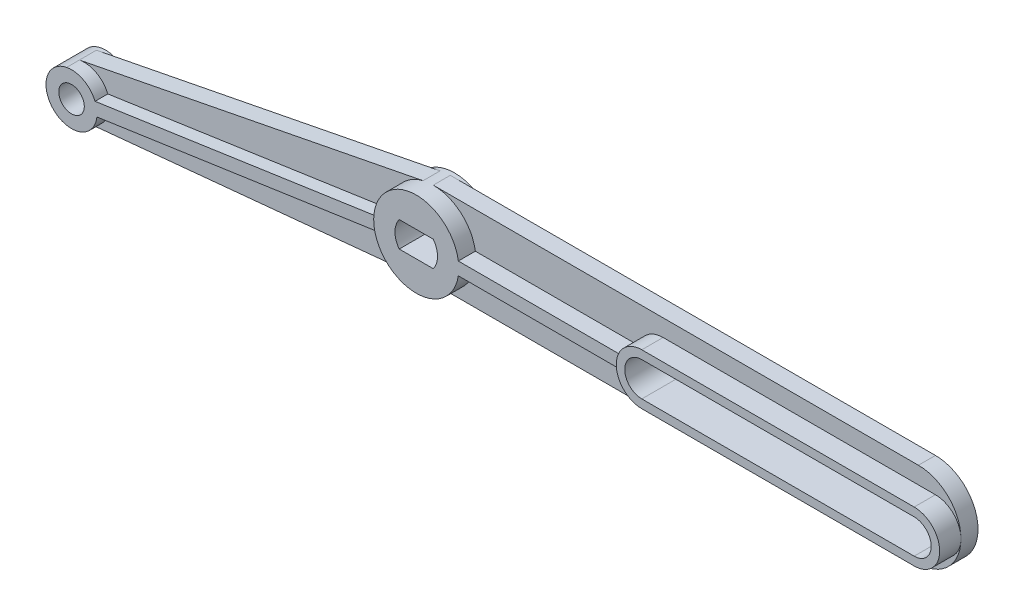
SolidWorks part; units mm, degrees
ref_plane "Face" through (0, 0, 0) normal (0, 0, 1) x (1, 0, 0)
ref_plane "Dessus" through (0, 0, 0) normal (0, 1, 0) x (1, 0, 0)
ref_plane "Droite" through (0, 0, 0) normal (1, 0, 0) x (0, 0, -1)
sketch "Esquisse2" plane through (0, 0, 0) normal (0, 0, 1) x (1, 0, 0)
  line L0 (0, 0) -> (120.7387, 0) construction
  line L1 (0, -5) -> (57, -5)
  line L2 (0, -5) -> (0, 5)
  line L3 (0, 5) -> (57, 5)
  arc A0 (57, -5) -> (57, 5) centre (57, 0) ccw
  dimension "D3" = 10
  dimension "D1" = 10
  dimension "D2" = 5
  dimension "D4" = 57
extrude "Extrusion1" add sketch "Esquisse2" along normal blind 2
sketch "Esquisse3" plane through (0, 0, 2) normal (0, 0, 1) x (1, 0, 0)
  circle A0 centre (0, 0) radius 5
  dimension "D1" = 10
extrude "Extrusion2" add sketch "Esquisse3" along normal blind 2 and the other way blind 2.5
sketch "Esquisse4" plane through (0, 0, 0) normal (0, 0, 1) x (1, 0, 0)
  line L0 (0, 0) -> (-49.7114, -7.2748) construction
  line L1 (-0.724, 4.9473) -> (-41.5768, -3.056)
  line L2 (0.724, -4.9473) -> (-40.4228, -8.944)
  arc A0 (-41.5768, -3.056) -> (-40.4228, -8.944) centre (-41, -6) ccw
  circle A1 centre (0, 0) radius 5 construction
  arc A2 (0.724, -4.9473) -> (-0.724, 4.9473) centre (0, 0) ccw
  point P4 (-41, -6)
  dimension "D1" = 6
  dimension "D6" = 41
  dimension "D2" = 6
extrude "Extrusion3" add sketch "Esquisse4" along normal blind 2
sketch "Esquisse5" plane through (0, 0, 2) normal (0, 0, 1) x (1, 0, 0)
  circle A0 centre (-41, -6) radius 3
  dimension "D1" = 41
  dimension "D2" = 6
extrude "Extrusion4" add sketch "Esquisse5" along normal blind 1.5 and the other way blind 2.5
sketch "Esquisse6" plane through (0, 0, 2) normal (0, 0, 1) x (1, 0, 0)
  line L0 (57, 0) -> (0, 0) construction
  line L3 (27, -3) -> (59, -3)
  line L4 (27, 3) -> (59, 3)
  arc A2 (27, 3) -> (27, -3) centre (27, 0) ccw
  arc A3 (59, -3) -> (59, 3) centre (59, 0) ccw
  dimension "D1" = 3
  dimension "D2" = 30
extrude "Extrusion5" add sketch "Esquisse6" along normal blind 2.5
sketch "Esquisse9" plane through (0, 0, 3.5) normal (0, 0, 1) x (1, 0, 0)
  line L0 (-41, -6) -> (0, 0)
  dimension "D1" = 41
  dimension "D2" = 6
rib "Nervure2" sketch "Esquisse9" sketch "Esquisse9" thickness 1.5 extrusion direction normal to sketch draft on no parameters "D1"=1.5
sketch "Esquisse10" plane through (0, 0, 4) normal (0, 0, 1) x (1, 0, 0)
  line L0 (-2, 1.5) -> (2, 1.5)
  line L1 (-2, -1.5) -> (2, -1.5)
  arc A0 (2, -1.5) -> (2, 1.5) centre (0, 0) ccw
  circle A1 centre (-41, -6) radius 1.5
  arc A2 (-2, 1.5) -> (-2, -1.5) centre (0, 0) ccw
  dimension "D1" = 5
  dimension "D2" = 3
  dimension "D3" = 41
  dimension "D4" = 6
  dimension "D5" = 1.5
  dimension "D6" = 3
extrude "Enlèv. mat.-Extru.2" cut sketch "Esquisse10" against normal through all
sketch "Esquisse11" plane through (0, 0, 4.5) normal (0, 0, 1) x (1, 0, 0)
  line L0 (27, 2) -> (59, 2)
  line L1 (27, -2) -> (59, -2)
  arc A0 (27, 2) -> (27, -2) centre (27, 0) ccw
  arc A1 (59, -2) -> (59, 2) centre (59, 0) ccw
  dimension "D1" = 4
  dimension "D2" = 4
  dimension "D3" = 4
extrude "Enlèv. mat.-Extru.3" cut sketch "Esquisse11" against normal through all
sketch "Esquisse12" plane through (0, 0, 4) normal (0, 0, 1) x (1, 0, 0)
  line L0 (5, 0) -> (24, 0)
  circle A0 centre (0, 0) radius 5 construction
  arc A1 (27, 3) -> (27, -3) centre (27, 0) ccw construction
rib "Nervure3" sketch "Esquisse12" sketch "Esquisse12" thickness 1.5 extrusion direction normal to sketch draft on no parameters "D1"=1.5
